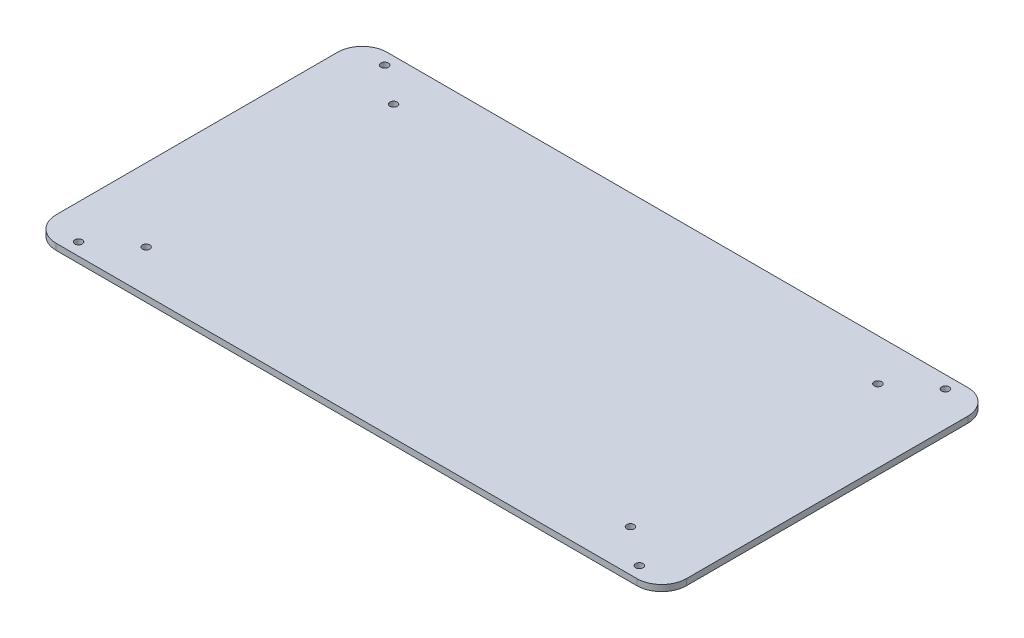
SolidWorks part; units mm, degrees
ref_plane "Front Plane" through (0, 0, 0) normal (0, 0, 1) x (1, 0, 0)
ref_plane "Top Plane" through (0, 0, 0) normal (0, 1, 0) x (1, 0, 0)
ref_plane "Right Plane" through (0, 0, 0) normal (1, 0, 0) x (0, 0, -1)
sketch "Sketch1" plane through (0, 0, 0) normal (0, 1, 0) x (1, 0, 0)
  line L1 (-127, 66.675) -> (127, 66.675)
  line L2 (-127, 66.675) -> (-127, -66.675)
  line L3 (-127, -66.675) -> (127, -66.675)
  line L4 (127, 66.675) -> (127, -66.675)
  line L5 (-127, 66.675) -> (127, -66.675) construction
  line L6 (-127, -66.675) -> (127, 66.675) construction
  point P0 (0, 0)
  dimension "D1" = 254
  dimension "D2" = 133.35
extrude "Boss-Extrude1" add sketch "Sketch1" along normal blind 2.5
fillet "Fillet1" radius 10 4 edges at (127, 1.25, 66.675) (127, 1.25, -66.675) (-127, 1.25, -66.675) (-127, 1.25, 66.675)
sketch "Sketch2" plane through (0, 0, 0) normal (0, 1, 0) x (1, 0, 0)
  line L0 (117, 66.675) -> (-117, 66.675) construction
  line L1 (-117, -66.675) -> (117, -66.675) construction
  line L2 (-127, 56.675) -> (-127, -56.675) construction
  line L3 (127, -56.675) -> (127, 56.675) construction
  circle A0 centre (-113, 61.675) radius 1.5
  circle A1 centre (-113, -61.675) radius 1.5
  circle A2 centre (113, 61.675) radius 1.5
  circle A3 centre (113, -61.675) radius 1.5
  dimension "D1" = 3
  dimension "D2" = 3
  dimension "D3" = 3
  dimension "D4" = 3
  dimension "D5" = 5
  dimension "D6" = 5
  dimension "D7" = 5
  dimension "D8" = 5
  dimension "D9" = 14
  dimension "D10" = 14
  dimension "D11" = 14
  dimension "D12" = 14
extrude "Cut-Extrude4" cut sketch "Sketch2" against normal blind 4.5 and the other way blind 8
sketch "Sketch3" plane through (0, 2.5, 0) normal (0, 1, 0) x (1, 0, 0)
  line L0 (0, 66.675) -> (0, -66.675) construction
  line L1 (117, 66.675) -> (-117, 66.675) construction
  line L2 (-117, -66.675) -> (117, -66.675) construction
  line L3 (-101.6, 50.975) -> (-98.6, 50.975) construction
  line L4 (-98.6, 53.975) -> (-101.6, 53.975)
  line L5 (-101.6, 53.975) -> (-101.6, -53.975)
  line L6 (-101.6, -53.975) -> (101.6, -53.975)
  line L7 (101.6, 53.975) -> (101.6, -53.975)
  line L8 (101.6, 0) -> (-101.6, 0) construction
  line L9 (-101.6, -53.975) -> (101.6, 53.975) construction
  line L10 (-98.6, 50.975) -> (-98.6, 53.975) construction
  line L11 (-101.6, -50.975) -> (-98.6, -50.975) construction
  line L12 (-98.6, -50.975) -> (-98.6, -53.975) construction
  line L13 (101.6, -50.975) -> (98.6, -50.975) construction
  line L14 (98.6, -50.975) -> (98.6, -53.975) construction
  line L15 (98.6, 53.975) -> (98.6, 50.975) construction
  line L16 (98.6, 50.975) -> (101.6, 50.975) construction
  line L17 (101.6, 53.975) -> (98.6, 53.975)
  circle A0 centre (97.597, 49.8596) radius 1.5
  circle A1 centre (97.597, -49.8596) radius 1.5
  circle A2 centre (-97.597, 49.8596) radius 1.5
  circle A3 centre (-97.597, -49.8596) radius 1.5
  point P6 (0, 0)
  dimension "D10" = 3
  dimension "D11" = 1.5
  dimension "D1" = 203.2
  dimension "D2" = 107.95
  dimension "D3" = 3
  dimension "D4" = 3
  dimension "D5" = 3
  dimension "D6" = 3
  dimension "D7" = 3
  dimension "D8" = 3
  dimension "D9" = 3
extrude "Cut-Extrude5" cut sketch "Sketch3" against normal blind 10 contours A0 | A1 | A2 | A3
